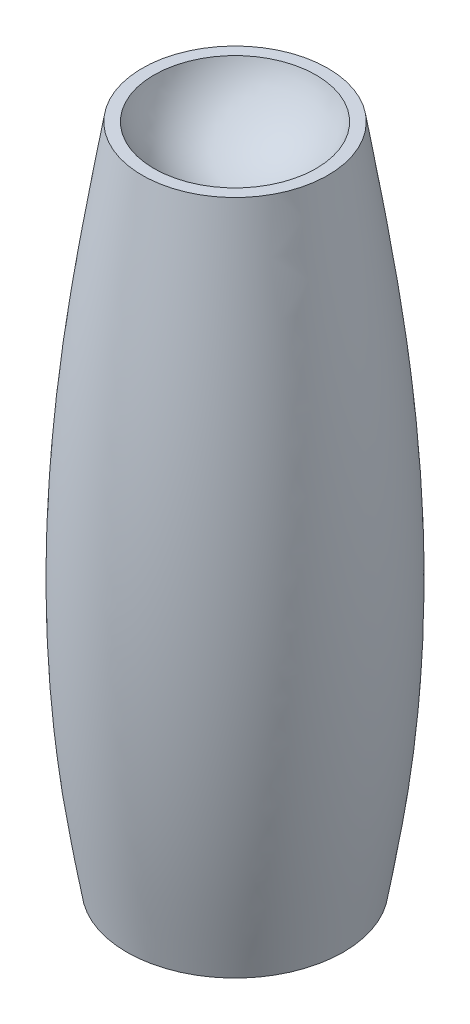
SolidWorks part; units mm, degrees
ref_plane "Plan de face" through (0, 0, 0) normal (0, 0, 1) x (1, 0, 0)
ref_plane "Plan de dessus" through (0, 0, 0) normal (0, 1, 0) x (1, 0, 0)
ref_plane "Plan de droite" through (0, 0, 0) normal (1, 0, 0) x (0, 0, -1)
sketch "Esquisse1" plane through (0, 0, 0) normal (0, 0, 1) x (1, 0, 0)
  line L0 (0, 0) -> (0, 78.3179) construction
  line L1 (0, 0) -> (-42, 0)
  line L2 (0, 0) -> (0, 258)
  line L3 (0, 258) -> (-36, 258)
  spline_without_curve S0
  dimension "D1" = 84
  dimension "D2" = 72
  dimension "D3" = 258
revolve "Révolution1" add sketch "Esquisse1" angle 360 about L2
sketch "Esquisse2" plane through (0, 0, 0) normal (0, 0, 1) x (1, 0, 0)
  line L0 (0, -98.6179) -> (0, 117.7636) construction
  line L1 (0, 18) -> (0, -78)
  arc A0 (0, -78) -> (0, 18) centre (0, -30) ccw
  dimension "D1" = 96
  dimension "D2" = 30
revolve "Enlèvement de matière-Révolution1" cut sketch "Esquisse2" angle 360 about L0
sketch "Esquisse3" plane through (0, 0, 0) normal (0, 0, 1) x (1, 0, 0)
  line L0 (0, -19.2584) -> (0, 287.5139) construction
  line L1 (36, 258) -> (-36, 258) construction
  line L2 (0, 301) -> (0, 235)
  arc A0 (0, 235) -> (0, 301) centre (0, 268) ccw
  dimension "D1" = 66
  dimension "D2" = 10
revolve "Enlèvement de matière-Révolution2" cut sketch "Esquisse3" angle 360 about L0
